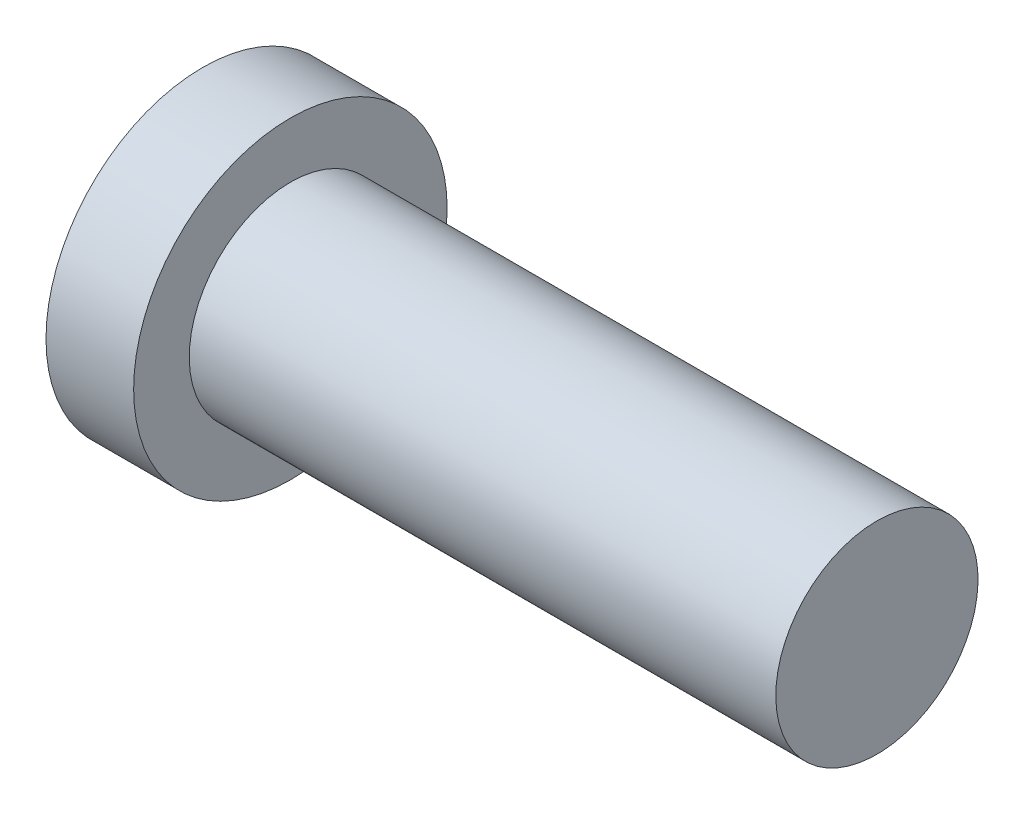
SolidWorks part; units mm, degrees
ref_plane "Front" through (0, 0, 0) normal (0, 0, 1) x (1, 0, 0)
ref_plane "Top" through (0, 0, 0) normal (0, 1, 0) x (1, 0, 0)
ref_plane "Right" through (0, 0, 0) normal (1, 0, 0) x (0, 0, -1)
sketch "Sketch1" plane through (-21.0632, 25.6102, 0) normal (0, 0, 1) x (0, -1, 0)
  line L0 (25.6102, 21.0632) -> (26.0002, 21.0632)
  line L1 (26.0002, 21.0632) -> (26.0002, 21.3546)
  line L2 (26.2375, 21.6181) -> (27.9352, 21.7966)
  line L3 (27.9352, 21.7966) -> (27.9352, 23.0966)
  line L4 (27.9352, 23.0966) -> (27.1102, 23.0966)
  line L5 (27.1102, 23.0966) -> (27.1102, 31.7966)
  line L6 (27.1102, 31.7966) -> (25.6102, 31.7966)
  line L7 (25.6102, 31.7966) -> (25.6102, 21.0632)
  line L8 (25.6102, 50.0506) -> (25.6102, -3.3772) construction
  line L9 (26.0002, 21.5932) -> (30.1572, 21.5932) construction
  arc A0 (26.0002, 21.3546) -> (26.2375, 21.6181) centre (26.2652, 21.3546) cw
  dimension "D3" = 0.265
  dimension "h" = 1.3
  dimension "l" = 10
  dimension "l2" = 0.53
  dimension "d" = 3
  dimension "d1" = 4.65
  dimension "d2" = 0.78
  dimension "D7" = 6
revolve "Revolve1" add sketch "Sketch1" angle 360 about L8
equation "\"D3@Sketch1\" = \"l2@Sketch1\" / 2"
